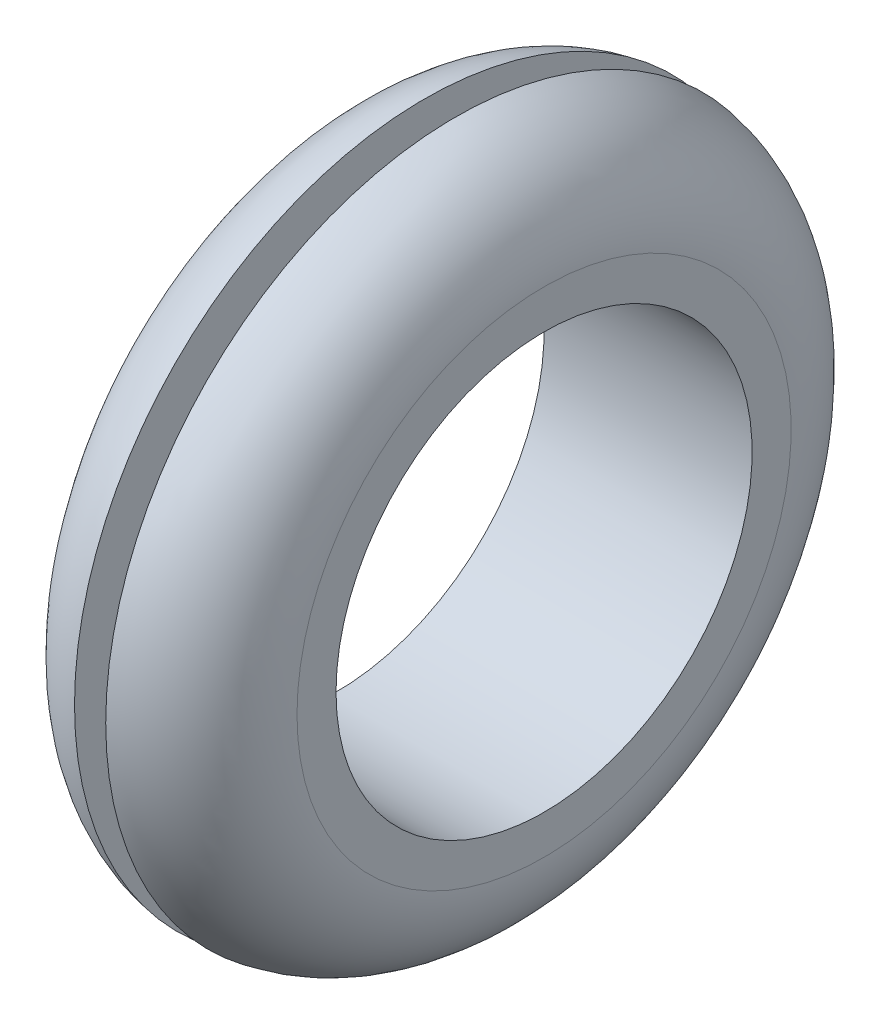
SolidWorks part; units mm, degrees
ref_plane "Plan de face" through (0, 0, 0) normal (0, 0, 1) x (1, 0, 0)
ref_plane "Plan de dessus" through (0, 0, 0) normal (0, 1, 0) x (1, 0, 0)
ref_plane "Plan de droite" through (0, 0, 0) normal (1, 0, 0) x (0, 0, -1)
ref_plane "Plan1" through (0, 0, 0) normal (0, 0, -1) x (-1, 0, 0)
sketch "Esquisse1" plane through (0, 0, 0) normal (0, 0, -1) x (-1, 0, 0)
  line L0 (-4, 8) -> (4, 8)
  line L1 (4, 8) -> (4, 9.5)
  line L2 (0.6, 13.4547) -> (0.6, 10.25)
  line L3 (0.6, 10.25) -> (-0.6, 10.25)
  line L4 (-0.6, 10.25) -> (-0.6, 13.4547)
  line L5 (-4, 9.5) -> (-4, 8)
  line L6 (-4.0013, 0) -> (4.0013, 0) construction
  arc A0 (4, 9.5) -> (0.6, 13.4547) centre (0, 9.5) ccw
  arc A1 (-0.6, 13.4547) -> (-4, 9.5) centre (0, 9.5) ccw
revolve "Révolution1" add sketch "Esquisse1" angle 360 about L6
